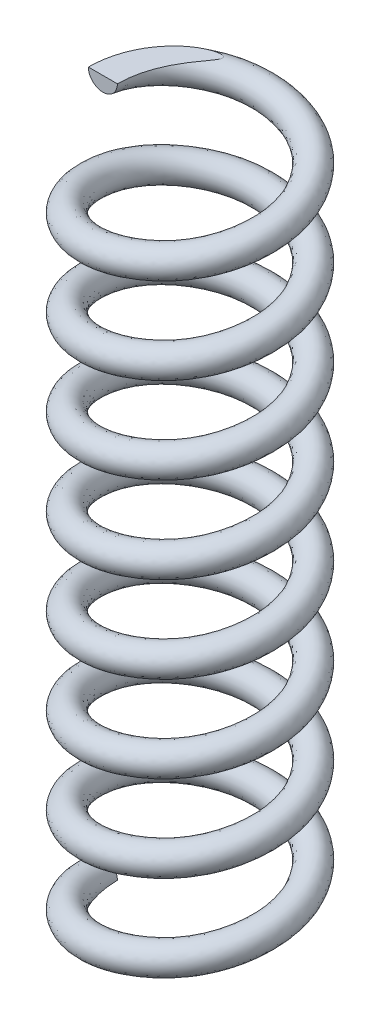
SolidWorks part; units mm, degrees
ref_plane "Front Plane" through (0, 0, 0) normal (0, 0, 1) x (1, 0, 0)
ref_plane "Top Plane" through (0, 0, 0) normal (0, 1, 0) x (1, 0, 0)
ref_plane "Right Plane" through (0, 0, 0) normal (1, 0, 0) x (0, 0, -1)
sketch "Sketch1" plane through (0, 0, 0) normal (0, 0, 1) x (1, 0, 0)
  line L0 (0, 32.5) -> (0, 80)
  line L1 (-6.5, 32.5) -> (6.5, 32.5) construction
  line L2 (-6.5876, 80) -> (4.3429, 80) construction
  point P4 (0, 0)
sketch "Sketch2" plane through (0, 0, 0) normal (0, 0, 1) x (1, 0, 0)
  line L0 (0, 32.5) -> (0, 80) construction
  circle A0 centre (-6, 32.5) radius 1
  dimension "D1" = 2
  dimension "D2" = 6
sweep "Sweep1" add profiles "Sketch2" path "Sketch1" parameters "D4"=2880
ref_plane "Plane1" through (0, 80, 0) normal (0, -1, 0) x (-1, 0, 0)
ref_plane "Plane2" through (0, 32.5, 0) normal (0, 1, 0) x (1, 0, 0)
other "SurfaceCut1"
other "SurfaceCut2"
